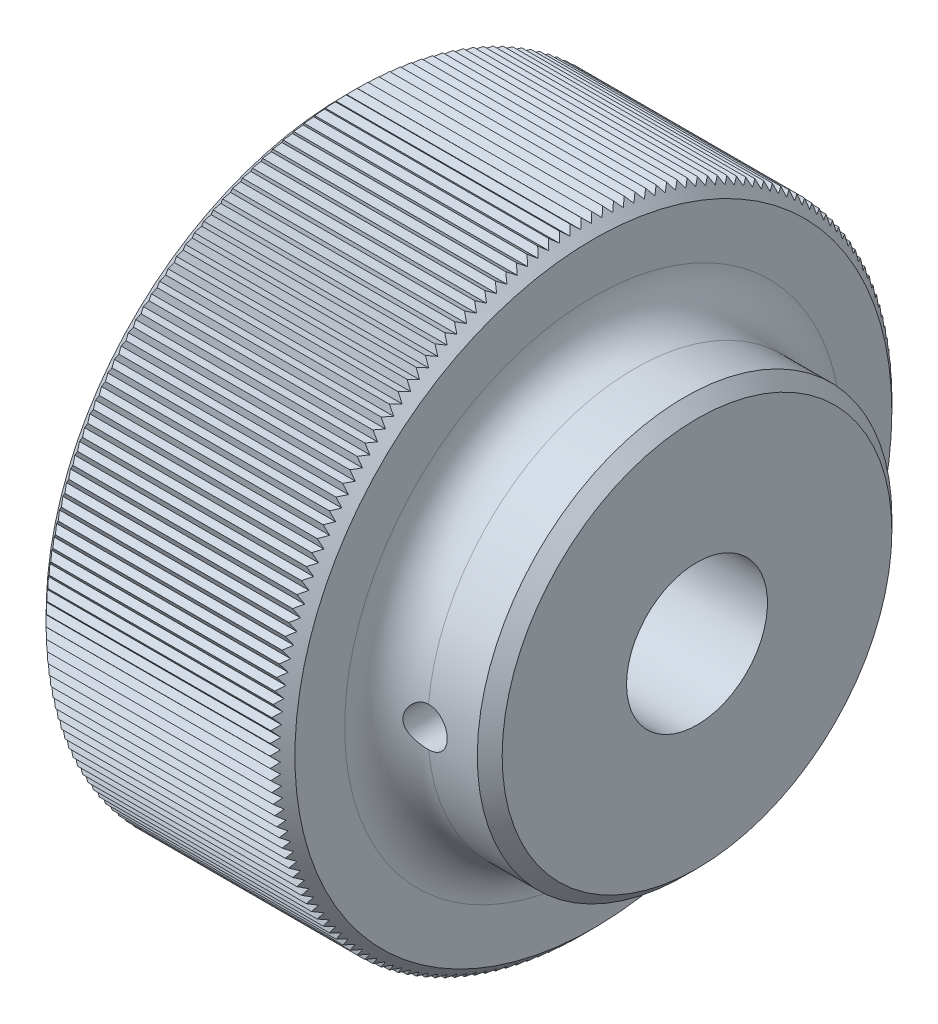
SolidWorks part; units mm, degrees
ref_plane "Front Plane" through (0, 0, 0) normal (0, 0, 1) x (1, 0, 0)
ref_plane "Top Plane" through (0, 0, 0) normal (0, 1, 0) x (1, 0, 0)
ref_plane "Right Plane" through (0, 0, 0) normal (1, 0, 0) x (0, 0, -1)
sketch "Sketch1" plane through (0, 0, 0) normal (1, 0, 0) x (0, 0, -1)
  circle A0 centre (0, 0) radius 15
  dimension "D1" = 30
extrude "Extrude1" add sketch "Sketch1" against normal blind 12
chamfer "Chamfer1" distance 0.6 angle 45 2 edges at (-12, 0, -15) (0, 0, -15)
sketch "Sketch2" plane through (0, 0, 0) normal (1, 0, 0) x (0, 0, -1)
  line L0 (0, 0) -> (0, 50000) construction
  line L1 (0, 0) -> (-872.6203, 49992.3848) construction
  line L2 (0, 15) -> (-0.2575, 14.75)
  line L3 (-0.5235, 14.9909) -> (-0.2575, 14.75)
  circle A0 centre (0, 0) radius 15 construction
  arc A1 (-0.5235, 14.9909) -> (0, 15) centre (-0.2666, 15.2746) cw
  dimension "D1" = 1
  dimension "D2" = 0.25
extrude "Extrude2" cut sketch "Sketch2" against normal through all
pattern_circular "CirPattern1" count 180 over 360 about axis through (0, 0, 0) along (1, 0, 0) of "Extrude2"
sketch "Sketch3" plane through (0, 0, 0) normal (1, 0, 0) x (0, 0, -1)
  circle A0 centre (0, 0) radius 10
  dimension "D1" = 20
extrude "Extrude3" add sketch "Sketch3" along normal blind 5
fillet "Fillet1" radius 2 1 edges at (0, 0, -10)
sketch "Sketch4" plane through (-12, 0, 0) normal (-1, 0, 0) x (0, 0, 1)
  circle A0 centre (0, 0) radius 3.4
  dimension "D1" = 6.8
extrude "Extrude4" cut sketch "Sketch4" against normal through all
sketch "Sketch5" plane through (-12, 0, 0) normal (-1, 0, 0) x (0, 0, 1)
  circle A0 centre (0, 0) radius 12
  dimension "D1" = 24
extrude "Extrude5" cut sketch "Sketch5" against normal blind 7
chamfer "Chamfer2" distance 0.6 angle 45 3 edges at (-12, 0, 12) (5, 0, -10) (-5, 0, 3.4)
sketch "Sketch6" plane through (0, 0, 0) normal (0, 0, 1) x (1, 0, 0)
  line L0 (5, -9.4) -> (5, 9.4) construction
  circle A0 centre (2, 0) radius 0.95
  dimension "D1" = 1.9
  dimension "D2" = 3
extrude "Extrude6" cut sketch "Sketch6" along normal through all
